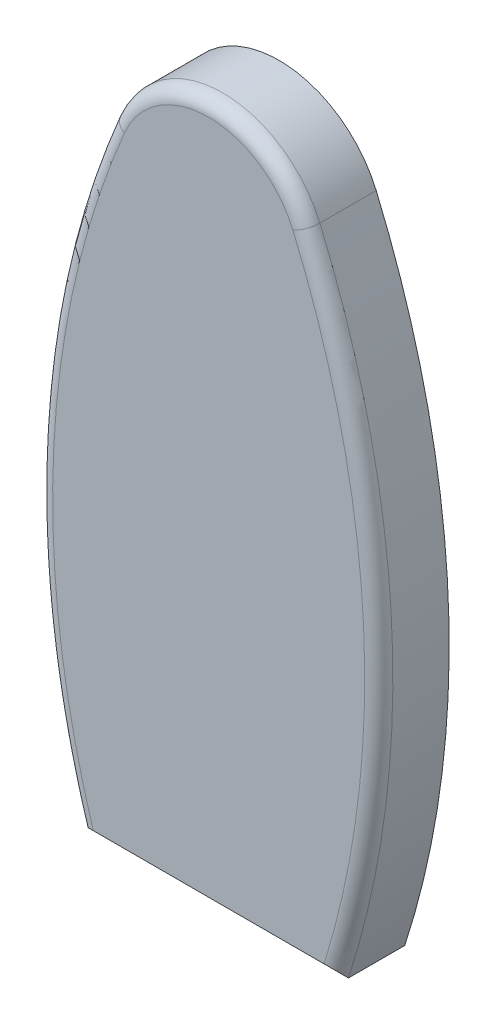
SolidWorks part; units mm, degrees
ref_plane "Ebene vorne" through (0, 0, 0) normal (0, 0, 1) x (1, 0, 0)
ref_plane "Ebene oben" through (0, 0, 0) normal (0, 1, 0) x (1, 0, 0)
ref_plane "Ebene rechts" through (0, 0, 0) normal (1, 0, 0) x (0, 0, -1)
sketch "Skizze1" plane through (0, 0, 0) normal (0, 0, 1) x (1, 0, 0)
  line L0 (-91.341, 0) -> (0, 0) construction
  line L1 (0, 0) -> (0, 131.8065) construction
  line L2 (-17.8631, -30) -> (17.8631, -30)
  arc A0 (-13.8039, 60.8696) -> (-17.8631, -30) centre (105.8301, 10) ccw
  arc A1 (13.8039, 60.8696) -> (-13.8039, 60.8696) centre (0, 55) ccw
  arc A2 (13.8039, 60.8696) -> (17.8631, -30) centre (-105.8301, 10) cw
  point P12 (0, -30)
  dimension "D3" = 15
  dimension "D4" = 130
  dimension "D5" = 100
  dimension "D1" = 10
  dimension "D2" = 30
extrude "Linear austragen1" add sketch "Skizze1" against normal blind 10
chamfer "Fase1" distance 2 angle 45 1 edges at (0, -30, 0)
fillet "Verrundung1" radius 2 3 edges at (23.9894, 16.8484, 0) (0, 70, 0) (-23.9894, 16.8484, 0)
shell "Wandung1" thickness 2
equation "\"LÄNGE\"=0"
equation "\"BREITE\"=0"
equation "\"HÖHE\"=0"
equation "\"DURCHMESSER\"=0"
equation "\"Stückzahl\"= 1"
